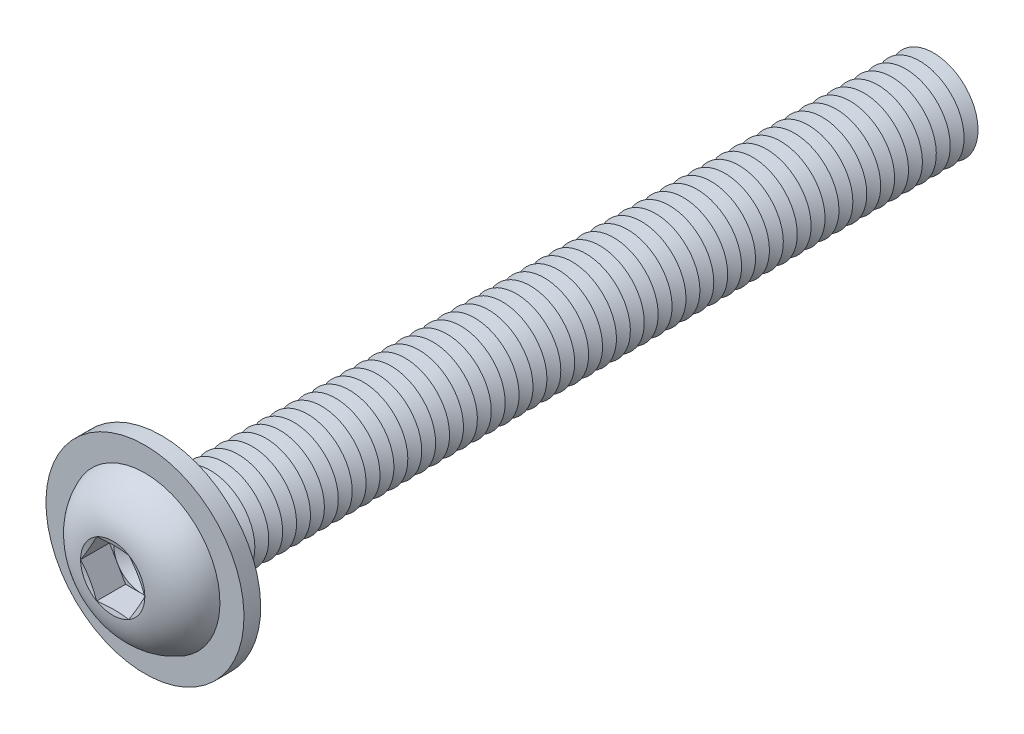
SolidWorks part; units mm, degrees
ref_plane "Front Plane" through (0, 0, 0) normal (0, 0, 1) x (1, 0, 0)
ref_plane "Top Plane" through (0, 0, 0) normal (0, 1, 0) x (1, 0, 0)
ref_plane "Right Plane" through (0, 0, 0) normal (1, 0, 0) x (0, 0, -1)
sketch "Sketch1" plane through (0, 0, 0) normal (1, 0, 0) x (0, 0, -1)
  line L0 (0, 4) -> (0, 7)
  line L3 (0, 4) -> (70, 4)
  line L4 (70, 4) -> (70, 0)
  line L5 (70, 0) -> (-4.4, 0) construction
  line L6 (-4.4, 0) -> (70, 0)
  line L7 (-4.4, 2.8867) -> (-4.4, 1.4434) construction
  line L8 (-4.4, 1.4434) -> (-4.4, 0)
  line L9 (-4.4, 2.8867) -> (-4.0132, 1.4434)
  line L10 (-4.0132, 1.4434) -> (-4.4, 1.4434)
  line L11 (70, 0) -> (22.7481, 0) construction
  line L12 (0, 7) -> (-4.4, 7) construction
  arc A1 (0, 7) -> (-4.4, 2.8867) centre (0, 2.59) ccw
  point P8 (70, 2)
  dimension "D1" = 14
  dimension "D2" = 8
  dimension "D3" = 4.4
  dimension "D4" = 5.7735
  dimension "D5" = 70
  dimension "D6" = 15
revolve "Revolve1" add sketch "Sketch1" angle 360 about L5
fillet "Fillet1" radius 0.625 1 edges at (0, 4, 0)
sketch "Sketch2" plane through (0, 0, 0) normal (1, 0, 0) x (0, 0, -1)
  line L0 (69.375, 4) -> (70.625, 4)
  line L1 (70, 4) -> (0.625, 4) construction
  line L2 (70.625, 4) -> (70, 2.9175)
  line L3 (70, -4) -> (70, 4) construction
  line L4 (70, 2.9175) -> (69.375, 4)
  dimension "D1" = 1.25
revolve "Cut-Revolve1" cut sketch "Sketch2" angle 360 about axis through (0, 0, -70) along (0, 0, -1)
pattern_linear "LPattern1" count 56 spacing 1.25 along (0, 0, 1) of "Cut-Revolve1"
sketch "Sketch3" plane through (0, 0, 4.4) normal (0, 0, 1) x (1, 0, 0)
  line L7 (1.4434, 2.5) -> (-1.4434, 2.5)
  line L8 (-1.4434, 2.5) -> (-2.8867, 0)
  line L9 (-2.8867, 0) -> (-1.4434, -2.5)
  line L10 (-1.4434, -2.5) -> (1.4434, -2.5)
  line L11 (1.4434, -2.5) -> (2.8867, 0)
  line L12 (2.8867, 0) -> (1.4434, 2.5)
  circle A0 centre (0, 0) radius 2.5 construction
  circle A3 centre (0, 0) radius 2.8867 construction
extrude "Cut-Extrude1" cut sketch "Sketch3" against normal blind 2.6
sketch "Sketch4" plane through (0, 0, 1.8) normal (0, 0, 1) x (1, 0, 0)
  line L1 (1.4434, 2.5) -> (-1.4434, 2.5) construction
  circle A0 centre (0, 0) radius 2.5
extrude "Cut-Extrude2" cut sketch "Sketch4" against normal through all draft 60
sketch "Sketch5" plane through (0, 0, 0) normal (0, 0, -1) x (-1, 0, 0)
  circle A0 centre (0, 0) radius 8.9
  circle A1 centre (0, 0) radius 4.625
  circle A2 centre (0, 0) radius 4.625 construction
  dimension "D1" = 17.8
extrude "Boss-Extrude1" add sketch "Sketch5" against normal blind 1.5
